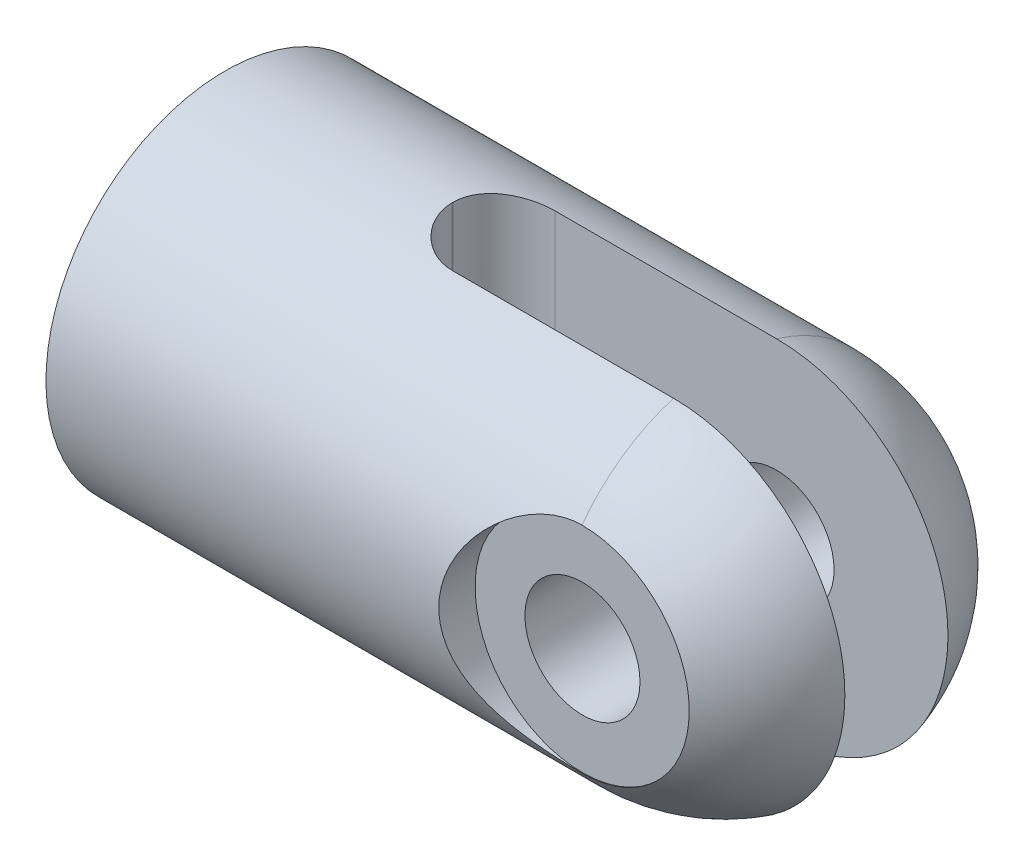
SolidWorks part; units mm, degrees
ref_plane "Front Plane" through (0, 0, 0) normal (0, 0, 1) x (1, 0, 0)
ref_plane "Top Plane" through (0, 0, 0) normal (0, 1, 0) x (1, 0, 0)
ref_plane "Right Plane" through (0, 0, 0) normal (1, 0, 0) x (0, 0, -1)
sketch "Sketch1" plane through (0, 0, 0) normal (0, 0, 1) x (1, 0, 0)
  line L0 (0, 6.2056) -> (0, 0) construction
  line L1 (-15.0622, 0) -> (15.0622, 0)
  line L2 (-15.0622, 0) -> (-15.0622, 7.9375)
  line L3 (-15.0622, 7.9375) -> (7.1247, 7.9375)
  arc A0 (15.0622, 0) -> (7.1247, 7.9375) centre (7.1247, 0) ccw
  dimension "D1" = 7.9375
  dimension "D2" = 30.1244
revolve "Revolve1" add sketch "Sketch1" angle 360 about L1
sketch "Sketch2" plane through (0, 0, 0) normal (0, 1, 0) x (1, 0, 0)
  line L0 (15.0622, 0) -> (-6.934, 0) construction
  line L5 (14.7259, 2.286) -> (-2.6985, 2.286)
  line L6 (14.7259, -2.286) -> (-2.6985, -2.286)
  line L7 (-4.9591, -0.0254) -> (-4.9591, 0.0254)
  line L9 (15.0622, 2.286) -> (-6.934, 2.286) construction
  line L10 (15.0622, -2.286) -> (-6.934, -2.286) construction
  arc A0 (7.1247, -7.9375) -> (7.1247, 7.9375) centre (7.1247, 0) ccw construction
  arc A1 (14.7259, -2.286) -> (14.7259, 2.286) centre (7.1247, 0) ccw
  arc A2 (-2.6985, -2.286) -> (-4.9591, -0.0254) centre (-2.6985, -0.0254) cw
  arc A3 (-4.9591, 0.0254) -> (-2.6985, 2.286) centre (-2.6985, 0.0254) cw
  dimension "D4" = 2.2606
  dimension "D3" = 19.685
  dimension "D1" = 2.286
  dimension "D2" = 4.572
extrude "Cut-Extrude1" cut sketch "Sketch2" against normal mid plane 254
sketch "Sketch5" plane through (-15.0622, 0, 0) normal (-1, 0, 0) x (0, 0, 1)
  line L0 (0, 0) -> (0, 7.9375) construction
  circle A0 centre (0, 0) radius 7.9375 construction
hole_wizard "Tapped Hole for #10-32 Helicoil1" positions "3DSketch4" profile "Sketch8" tap size "#10-32" standard "Helicoil® Inch"
sketch3d "3DSketch4"
  point P0 (-15.0622, 0, 0)
sketch "Sketch8" plane through (-15.0622, 0, 0) normal (0, 1, 0) x (0, 0, 1)
  line L0 (0, 0) -> (0, 8.5188)
  line L1 (0, 8.5188) -> (2.5527, 6.985)
  line L2 (2.5527, 6.985) -> (2.5527, 0)
  line L5 (2.5527, 0) -> (0, 0)
  line L10 (0, 8.5188) -> (-2.5527, 6.985) construction
  line L11 (0, -6.35) -> (0, 107.95) construction
  dimension "Tap Drill Dia." = 5.1054
  dimension "Tap Drill Depth" = 6.985
  dimension "Drill Angle" = 118
ref_plane "Plane1" through (0, 0, 8.128) normal (0, 0, 1) x (1, 0, 0)
sketch "Sketch9" plane through (0, 0, 8.128) normal (0, 0, 1) x (1, 0, 0)
  line L0 (7.1247, 0) -> (14.7259, 0) construction
  arc A0 (7.1247, -7.6012) -> (7.1247, 7.6012) centre (7.1247, 0) ccw construction
  arc A1 (7.1247, -7.6012) -> (7.1247, 7.6012) centre (7.1247, 0) ccw construction
sketch "Sketch10" plane through (0, 0, 8.128) normal (0, 0, 1) x (1, 0, 0)
  circle A0 centre (7.1247, 0) radius 4.7625
  dimension "D1" = 9.525
extrude "Cut-Extrude2" cut sketch "Sketch10" against normal blind 1.8034
sketch "Sketch12" plane through (0, 0, 6.3246) normal (0, 0, 1) x (1, 0, 0)
  line L0 (7.1247, 0) -> (14.7259, 0) construction
  line L1 (7.1247, 0) -> (14.7259, 0)
hole_wizard "#10 Clearance Hole1" positions "3DSketch6" profile "Sketch13" hole size "#10" standard "ANSI Inch"
sketch3d "3DSketch6"
  point P0 (7.1247, 0, 6.3246)
sketch "Sketch13" plane through (7.1247, 0, 6.3246) normal (1, 0, 0) x (0, -1, 0)
  line L0 (0, 0) -> (0, 7.8838)
  line L1 (0, 7.8838) -> (2.5527, 6.35)
  line L2 (2.5527, 6.35) -> (2.5527, 0)
  line L5 (2.5527, 0) -> (0, 0)
  line L10 (0, 7.8838) -> (-2.5527, 6.35) construction
  line L11 (0, -6.35) -> (0, 107.95) construction
  dimension "Hole Dia." = 5.1054
  dimension "Hole Depth" = 6.35
  dimension "Drill Angle" = 118
sketch "Sketch14" plane through (0, 0, -2.286) normal (0, 0, 1) x (1, 0, 0)
  line L0 (7.1247, 0) -> (14.7259, 0) construction
  line L1 (7.1247, 0) -> (14.7259, 0)
hole_wizard "Tapped Hole for #10-32 Helicoil2" positions "3DSketch7" profile "Sketch15" tap size "#10-32" standard "Helicoil® Inch"
sketch3d "3DSketch7"
  point P0 (7.1247, 0, -2.286)
sketch "Sketch15" plane through (7.1247, 0, -2.286) normal (1, 0, 0) x (0, -1, 0)
  line L0 (0, 0) -> (0, 13.5226)
  line L1 (0, 13.5226) -> (2.5527, 11.9888)
  line L2 (2.5527, 11.9888) -> (2.5527, 0)
  line L5 (2.5527, 0) -> (0, 0)
  line L10 (0, 13.5226) -> (-2.5527, 11.9888) construction
  line L11 (0, -6.35) -> (0, 107.95) construction
  dimension "Tap Drill Dia." = 5.1054
  dimension "Tap Drill Depth" = 11.9888
  dimension "Drill Angle" = 118
